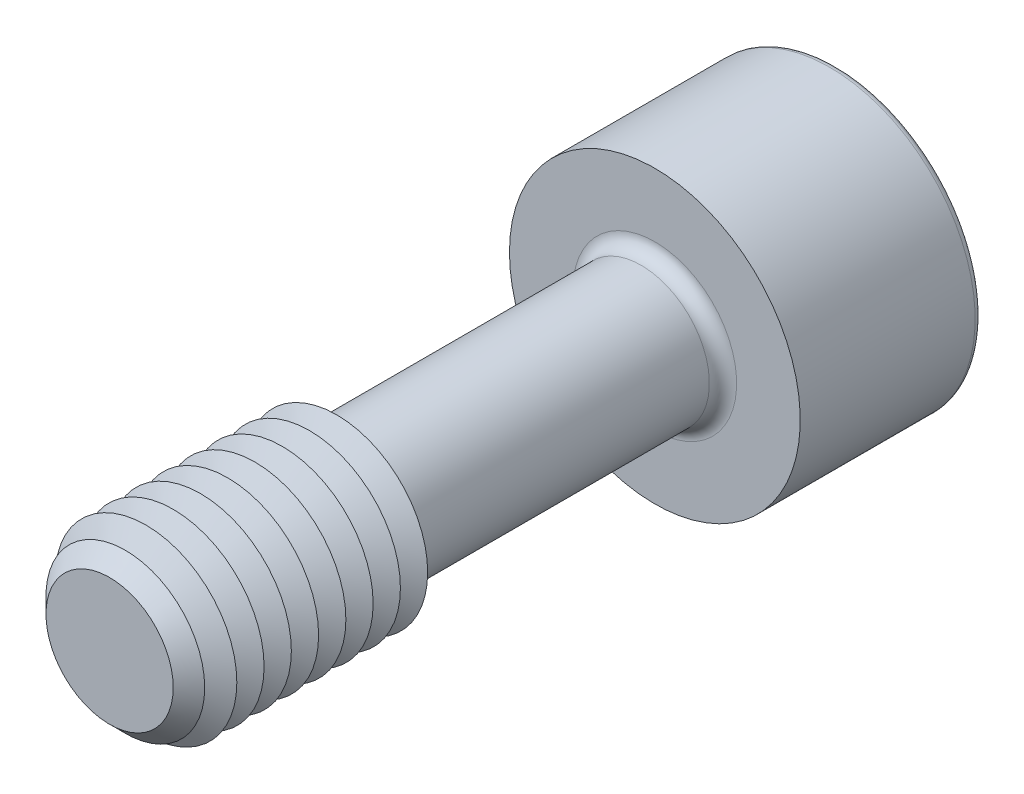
SolidWorks part; units mm, degrees
ref_plane "Front Plane" through (0, 0, 0) normal (0, 0, 1) x (1, 0, 0)
ref_plane "Top Plane" through (0, 0, 0) normal (0, 1, 0) x (1, 0, 0)
ref_plane "Right Plane" through (0, 0, 0) normal (1, 0, 0) x (0, 0, -1)
sketch "Sketch1" plane through (0, 0, 0) normal (0, 0, 1) x (1, 0, 0)
  circle A0 centre (0, 0) radius 3.75
  dimension "D1" = 7.5
extrude "Extrude1" add sketch "Sketch1" along normal mid plane 30
sketch "Sketch2" plane through (0, 0, 0) normal (1, 0, 0) x (0, 0, -1)
  line L0 (-15, 0) -> (-15, 5)
  line L1 (-15, 3.75) -> (-15, -3.75) construction
  line L2 (-15, 5) -> (-2.5, 5)
  line L3 (-2.5, 5) -> (-1.7783, 3.75)
  line L4 (15, 3.75) -> (-15, 3.75) construction
  line L5 (-1.7783, 3.75) -> (-1.7783, 0)
  line L6 (-1.7783, 0) -> (-15, 0)
  dimension "D1" = 5
  dimension "D2" = 120
  dimension "D3" = 12.5
revolve "Revolve1" add sketch "Sketch2" angle 360 about L6
chamfer "Chamfer1" distance 1.5 angle 45 1 edges at (0, 5, 15)
sketch "Sketch3" plane through (0, 0, -15) normal (0, 0, -1) x (-1, 0, 0)
  circle A0 centre (0, 0) radius 8
  dimension "D1" = 16
extrude "Extrude2" add sketch "Sketch3" along normal blind 10
sketch "Sketch4" plane through (-13.7, 0, -25) normal (0, 0, 1) x (1, 0, 0)
  line L2 (11.3906, -4) -> (16.0094, -4)
  line L3 (16.0094, -4) -> (18.3188, 0)
  line L4 (18.3188, 0) -> (16.0094, 4)
  line L6 (16.0094, 4) -> (11.3906, 4)
  line L7 (11.3906, 4) -> (9.0812, 0)
  line L8 (9.0812, 0) -> (11.3906, -4)
  circle A0 centre (13.7, 0) radius 4 construction
  dimension "D1" = 8
extrude "Extrude3" cut sketch "Sketch4" along normal blind 8
fillet "Fillet1" radius 0.75 1 edges at (-3.75, 0, -15)
fillet "Fillet2" radius 0.375 1 edges at (-8, 0, -25)
sketch "Sketch5" plane through (0, 0, 0) normal (1, 0, 0) x (0, 0, -1)
  line L0 (17, 0) -> (17, -4)
  line L1 (17, -4) -> (14.6906, 0)
  line L2 (14.6906, 0) -> (17, 0)
  dimension "D1" = 30
revolve "Cut-Revolve1" cut sketch "Sketch5" angle 360 about L2
sketch "Sketch6" plane through (0, 0, 0) normal (1, 0, 0) x (0, 0, -1)
  line L0 (1.332, 0) -> (-13.289, 0) construction
sketch "Sketch7" plane through (0, 0, 0) normal (1, 0, 0) x (0, 0, -1)
  line L0 (-2.5, 5) -> (-3.25, 3.701)
  line L1 (-3.25, 3.701) -> (-4, 5)
  line L2 (-2.5, 5) -> (-13.5, 5) construction
  line L3 (-4, 5) -> (-2.5, 5)
  dimension "D1" = 1.5
revolve "Cut-Revolve2" cut sketch "Sketch7" angle 360 about L0
pattern_linear "LPattern1" count 8 spacing 1.5 along (0, 0, 1) of "Cut-Revolve2"
